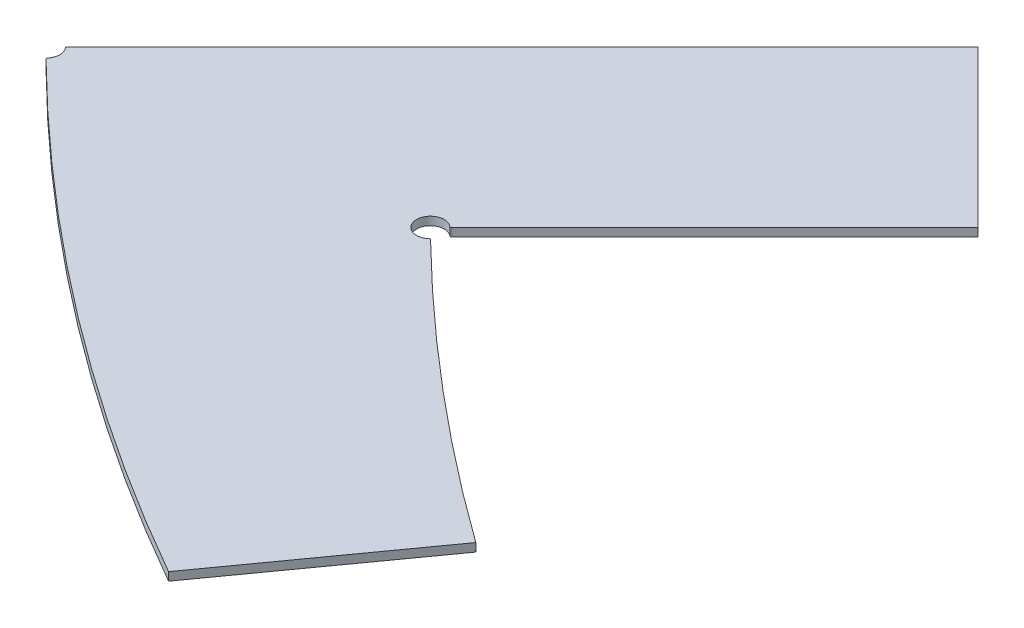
SolidWorks part; units mm, degrees
ref_plane "Front Plane" through (0, 0, 0) normal (0, 0, 1) x (1, 0, 0)
ref_plane "Top Plane" through (0, 0, 0) normal (0, 1, 0) x (1, 0, 0)
ref_plane "Right Plane" through (0, 0, 0) normal (1, 0, 0) x (0, 0, -1)
sketch "Sketch1" plane through (47.4659, 0, -3.64) normal (0, 1, 0) x (1, 0, 0)
  line L2 (-325.9228, -453.9072) -> (-355.404, -494.9652)
  line L3 (-471.4195, -402.2715) -> (-366.8412, -297.6932)
  line L4 (-325.8687, -328.5628) -> (-392.4099, -395.104) construction
  line L5 (-366.8412, -297.6932) -> (-330.9201, -333.6142)
  line L6 (-482.8177, -395.7093) -> (-464.8572, -413.6698) construction
  line L7 (-330.9201, -333.6142) -> (-391.3639, -394.058)
  line L8 (-391.0629, -396.451) -> (-324.5217, -329.9099) construction
  line L9 (-400.0704, -387.4981) -> (-382.1099, -405.4586) construction
  arc A1 (-471.4259, -406.7547) -> (-471.4323, -402.6169) centre (-473.8375, -404.6895) ccw
  arc A5 (-471.4115, -407.1006) -> (-355.404, -494.9652) centre (-80.0533, -10.9053) ccw
  arc A6 (-391.8349, -398.4003) -> (391.8349, -398.4003) centre (0, 0) ccw construction
  arc A7 (-391.3489, -398.8778) -> (-325.9228, -453.9072) centre (0, 0) ccw
  arc A8 (-392.4005, -397.8433) -> (-391.8349, -398.4003) centre (0, 0) ccw construction
  arc A9 (-391.7093, -394.0708) -> (-391.6938, -398.8678) centre (-393.7819, -396.476) ccw
  arc A10 (-391.7093, -394.0708) -> (-391.3639, -394.058) centre (-391.5435, -393.8784) ccw
  arc A11 (-391.6938, -398.8678) -> (-391.3489, -398.8778) centre (-391.5268, -399.0591) cw
  arc A15 (-390.4972, -397.044) -> (390.4972, -397.044) centre (0, 0) ccw construction
  arc A16 (-426.8375, -357.6895) -> (390.4972, -397.044) centre (0, 0) ccw construction
  arc A17 (-471.4323, -402.6169) -> (-471.4195, -402.2715) centre (-471.2399, -402.4511) cw
  arc A18 (-471.4115, -407.1006) -> (-471.4259, -406.7547) centre (-471.233, -406.9199) cw
  point P24 (-393.7819, -396.476)
  point P35 (-473.8375, -404.6895)
  point P37 (-471.5924, -402.4444)
  point P42 (-391.0902, -396.4783)
  point P44 (-391.0902, -396.4783)
  dimension "D1" = 1113.79
  dimension "D2" = 90
  dimension "D3" = 50.8
  dimension "D4" = 6.35
  dimension "D5" = 0.254
  dimension "D6" = 0.254
  dimension "D11" = 6.35
  dimension "D12" = 90
  dimension "D10" = 25.4
  dimension "D7" = 50.546
  dimension "D15" = 3.175
  dimension "D16" = 1113.79
  dimension "D17" = 0.254
  dimension "D8" = 88.9
  dimension "D9" = 88.9
extrude "Boss-Extrude1" add sketch "Sketch1" along normal mid plane 1.905
